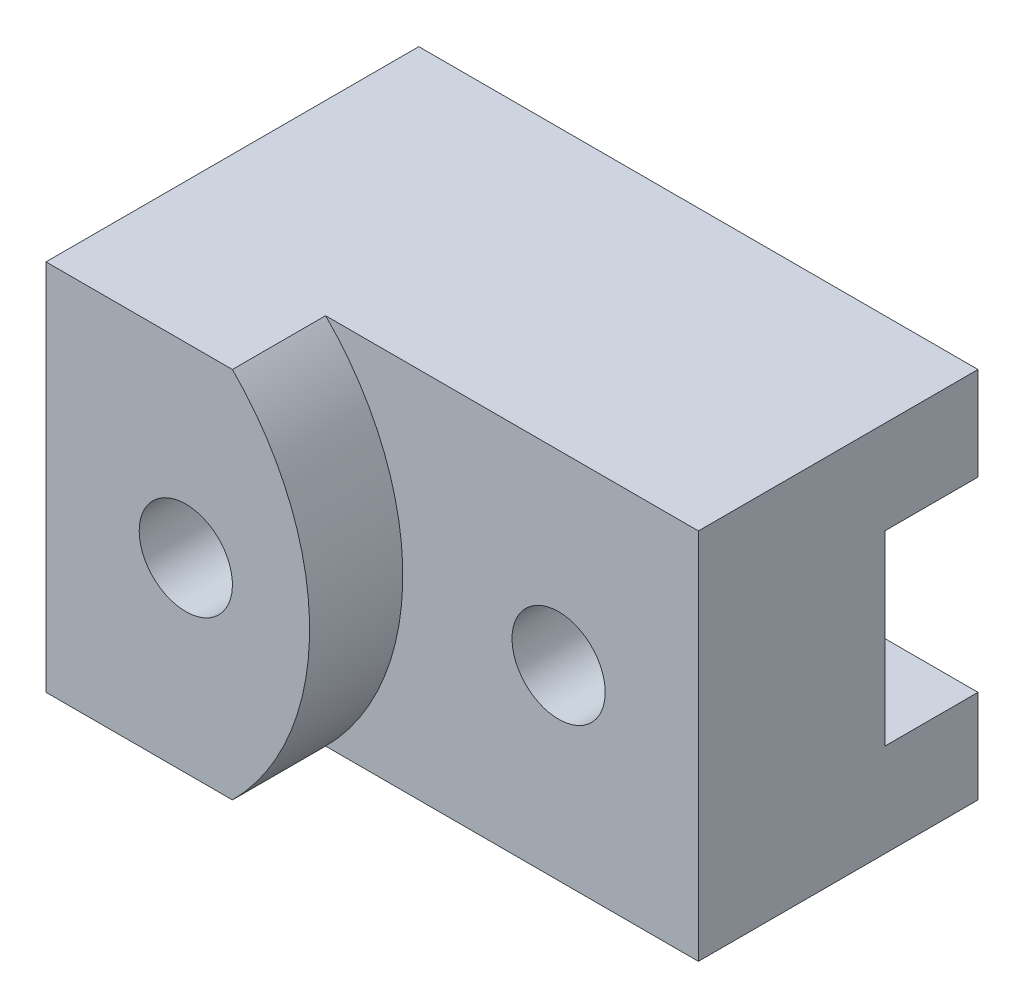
SolidWorks part; units mm, degrees
ref_plane "Front Plane" through (0, 0, 0) normal (0, 0, 1) x (1, 0, 0)
ref_plane "Top Plane" through (0, 0, 0) normal (0, 1, 0) x (1, 0, 0)
ref_plane "Right Plane" through (0, 0, 0) normal (1, 0, 0) x (0, 0, -1)
sketch "Sketch1" plane through (0, 0, 0) normal (1, 0, 0) x (0, 0, -1)
  line L1 (0, 0) -> (76.2, 0)
  line L2 (0, 0) -> (0, 101.6)
  line L3 (0, 101.6) -> (76.2, 101.6)
  line L4 (76.2, 0) -> (76.2, 101.6)
  line L5 (0, 0) -> (76.2, 101.6) construction
  line L6 (0, 101.6) -> (76.2, 0) construction
  line L7 (76.2, 25.4) -> (50.8, 25.4)
  line L8 (76.2, 25.4) -> (76.2, 76.2)
  line L9 (76.2, 76.2) -> (50.8, 76.2)
  line L10 (50.8, 25.4) -> (50.8, 76.2)
  line L11 (76.2, 25.4) -> (50.8, 76.2) construction
  line L12 (76.2, 76.2) -> (50.8, 25.4) construction
  point P4 (38.1, 50.8)
  point P10 (63.5, 50.8)
  point P11 (0, 0)
  point P12 (0, 0)
  point P13 (0, 0)
extrude "Boss-Extrude1" add sketch "Sketch1" against normal blind 152.4 contours L7 L10 L9 L4 L3 L2 L1
sketch "Sketch3" plane through (0, 0, -50.8) normal (0, 0, -1) x (-1, 0, 0)
  point P0 (38.1, 50.8)
  point P3 (0, 0)
hole_wizard "CBORE for 1/4 Binding Head Machine Screw1" positions "Sketch3" profile "Sketch4" counterbore size "1/4" standard "ANSI Inch"
sketch "Sketch4" plane through (-38.1, 50.8, -50.8) normal (1, 0, 0) x (0, 1, 0)
  line L0 (0, 0) -> (0, 50.8)
  line L1 (0, 50.8) -> (12.7, 50.8)
  line L3 (12.7, 50.8) -> (12.7, 5.08)
  line L4 (12.7, 5.08) -> (19.05, 5.08)
  line L5 (19.05, 5.08) -> (19.05, 0)
  line L7 (19.05, 0) -> (0, 0)
  line L11 (0, -6.35) -> (0, 107.95) construction
  dimension "Thru Hole Dia." = 25.4
  dimension "Thru Hole Depth" = 50.8
  dimension "C'Bore Dia." = 38.1
  dimension "C'Bore Depth" = 5.08
sketch "Sketch5" plane through (0, 0, -50.8) normal (0, 0, -1) x (-1, 0, 0)
  circle A0 centre (114.3, 50.8) radius 12.7
  point P2 (0, 0)
  point P3 (125.4874, 50.8)
  point P4 (0, 0)
  point P5 (0, 0)
  dimension "D1" = 25.4
sketch "Sketch6" plane through (0, 0, 0) normal (0, 0, 1) x (1, 0, 0)
  line L0 (-152.4, 0) -> (0, 0) construction
  line L1 (-152.4, 101.6) -> (-101.6, 101.6)
  line L2 (-152.4, 101.6) -> (-152.4, 0)
  line L3 (-152.4, 0) -> (-101.6, 0)
  line L5 (-152.4, 101.6) -> (-101.6, 0) construction
  line L6 (-152.4, 0) -> (-101.6, 101.6) construction
  arc A0 (-101.6, 101.6) -> (-101.6, 0) centre (-152.4, 50.8) cw
  point P4 (-127, 50.8)
extrude "Boss-Extrude2" add sketch "Sketch6" along normal blind 25.4 contours A0 L3 L2 L1
extrude "Cut-Extrude2" cut sketch "Sketch5" against normal up to surface (76.2 mm away)
